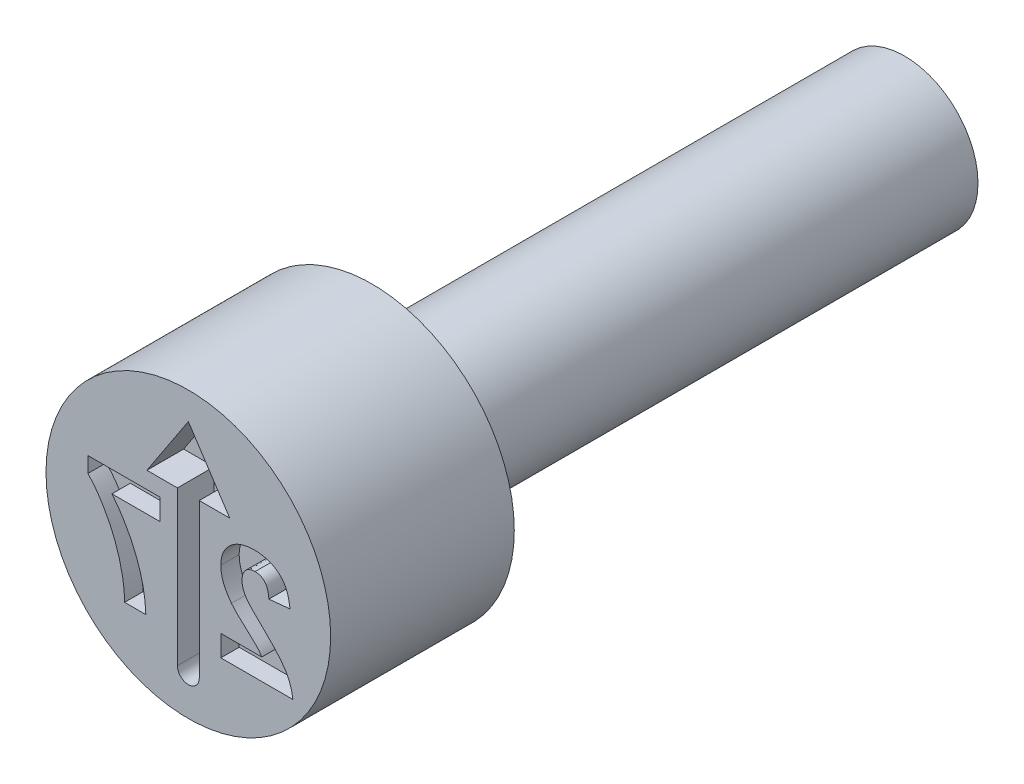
SolidWorks part; units mm, degrees
ref_plane "Front Plane" through (0, 0, 0) normal (0, 0, 1) x (1, 0, 0)
ref_plane "Top Plane" through (0, 0, 0) normal (0, 1, 0) x (1, 0, 0)
ref_plane "Right Plane" through (0, 0, 0) normal (1, 0, 0) x (0, 0, -1)
sketch "Sketch2" plane through (0, 0, 0) normal (1, 0, 0) x (0, 0, -1)
  line L0 (0.4039, 0) -> (50000.4039, 0) construction
  line L6 (0, 1.55) -> (0, 0)
  line L7 (2, 1.55) -> (0, 1.55)
  line L8 (2, 0.8) -> (2, 1.55)
  line L9 (7.8, 0.8) -> (2, 0.8)
  line L10 (7.8, 0) -> (7.8, 0.8)
  line L11 (0, 0) -> (7.8, 0)
  dimension "D1" = 3.1
  dimension "D2" = 1.6
  dimension "D3" = 7.8
  dimension "D4" = 2
revolve "Revolve1" add sketch "Sketch2" angle 360 about L0
sketch "Sketch3" plane through (0, 0, 0) normal (0, 0, 1) x (1, 0, 0)
  line L0 (0, 0) -> (0, 62500) construction
  line L1 (0.119, 0.5665) -> (0.119, -1.1101)
  line L2 (0.4512, 0.5665) -> (0.119, 0.5665)
  line L3 (0, 1.2513) -> (0.4512, 0.5665)
  line L15 (0, 1.2513) -> (-0.4512, 0.5665)
  line L16 (-0.4512, 0.5665) -> (-0.119, 0.5665)
  line L17 (-0.119, 0.5665) -> (-0.119, -1.1101)
  arc A2 (-0.119, -1.1101) -> (0.119, -1.1101) centre (0, -1.1101) ccw
extrude "Cut-Extrude4" cut sketch "Sketch3" against normal blind 0.4
sketch "Sketch4" plane through (0, 0, 0) normal (0, 0, 1) x (1, 0, 0)
  text T0 "2  7" font "Arial" height 1.2
  dimension "D1" = 0.8
  dimension "D2" = 1.2
extrude "Cut-Extrude5" cut sketch "Sketch4" against normal blind 0.2
